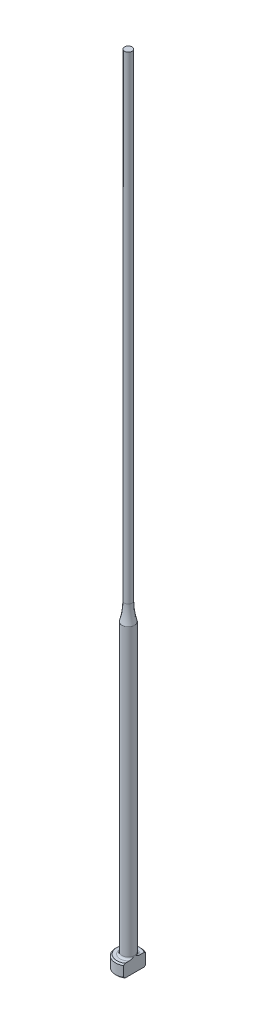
SolidWorks part; units mm, degrees
ref_plane "Front Plane" through (0, 0, 0) normal (0, 0, 1) x (1, 0, 0)
ref_plane "Top Plane" through (0, 0, 0) normal (0, 1, 0) x (1, 0, 0)
ref_plane "Right Plane" through (0, 0, 0) normal (1, 0, 0) x (0, 0, -1)
sketch "Sketch1" plane through (0, 0, 0) normal (0, 0, 1) x (1, 0, 0)
  line L0 (0, 259.9588) -> (0, -15.1925) construction
  line L1 (0, 0) -> (-2, 0)
  line L2 (-2, 0) -> (-2, 2)
  line L3 (-2, 2) -> (-1, 2)
  line L4 (-0.6, 50) -> (-0.6, 125)
  line L5 (-0.6, 125) -> (0, 125)
  line L6 (0, 125) -> (0, 0)
  line L7 (-1, 2) -> (-1, 47.2)
  arc A0 (-1, 47.2) -> (-0.6, 50) centre (-10.6, 50) ccw
  point P13 (-1, 0)
  dimension "D1" = 10
  dimension "L" = 125
  dimension "H" = 4
  dimension "T" = 2
  dimension "D" = 1.2
  dimension "B" = 2
  dimension "S" = 50
revolve "Revolve1" add sketch "Sketch1" angle 360 about L0
chamfer "Chamfer1" distance 0.2 angle 45 2 edges at (0, 2, 2) (0, 0, 2)
fillet "Fillet1" radius 0.3 1 edges at (0, 2, 1)
sketch "Sketch2" plane through (0, 0, 0) normal (0, 1, 0) x (1, 0, 0)
  line L0 (1, 1.7321) -> (1, -1.7321)
  circle A0 centre (0, 0) radius 2 construction
  arc A1 (1, -1.7321) -> (1, 1.7321) centre (0, 0) ccw
  circle A2 centre (0, 0) radius 1 construction
extrude "KEY" cut sketch "Sketch2" along normal through all
